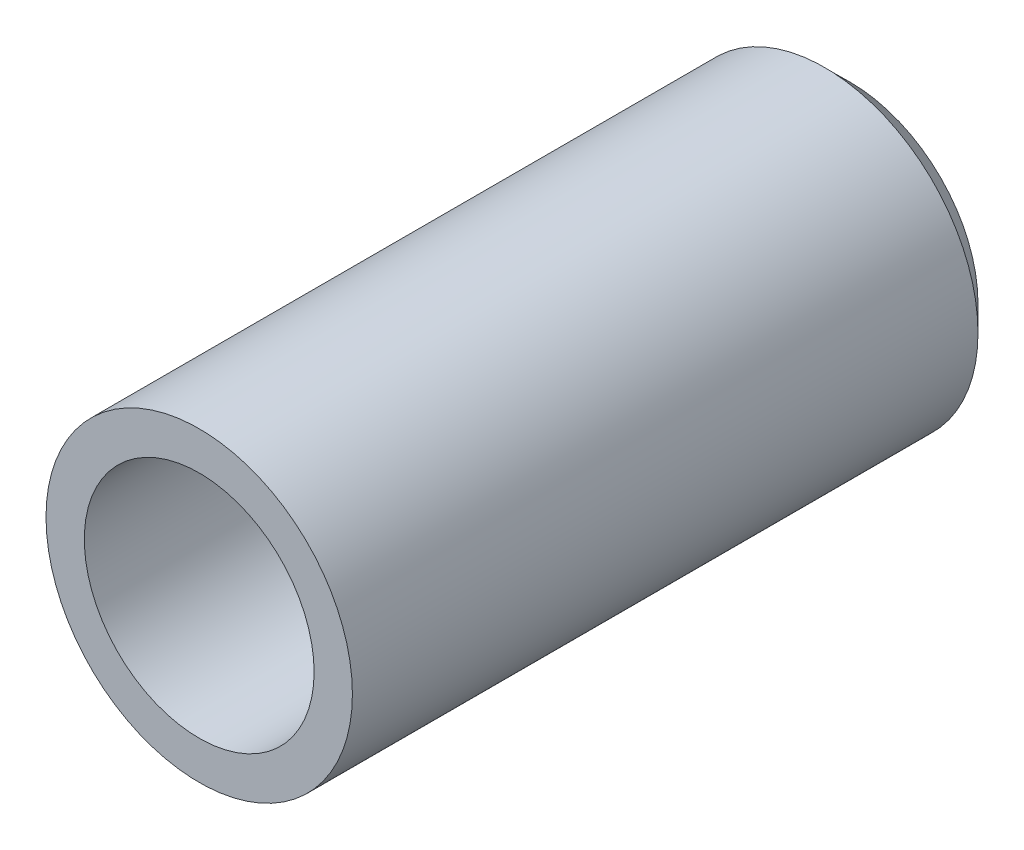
SolidWorks part; units mm, degrees
ref_plane "Face" through (0, 0, 0) normal (0, 0, 1) x (1, 0, 0)
ref_plane "Dessus" through (0, 0, 0) normal (0, 1, 0) x (1, 0, 0)
ref_plane "Droite" through (0, 0, 0) normal (1, 0, 0) x (0, 0, -1)
sketch "Esquisse1" plane through (0, 0, 0) normal (0, 0, 1) x (1, 0, 0)
  circle A0 centre (0, 0) radius 6
  dimension "D1" = 12
extrude "Base-Extrusion" add sketch "Esquisse1" along normal blind 25.5
sketch "Esquisse2" plane through (0, 0, 25.5) normal (0, 0, 1) x (1, 0, 0)
  circle A0 centre (0, 0) radius 4.5
  dimension "D1" = 9
extrude "Enlèv. mat.-Extru.1" cut sketch "Esquisse2" against normal blind 22.5
sketch "Esquisse3" plane through (0, 0, 0) normal (0, 0, -1) x (-1, 0, 0)
  circle A0 centre (0, 0) radius 3.02
  dimension "D1" = 6.04
extrude "Enlèv. mat.-Extru.2" cut sketch "Esquisse3" against normal through all
chamfer "Chanfrein1" distance 0.5 angle 45 1 edges at (3.02, 0, 3)
fillet "Congé1" radius 0.5 1 edges at (4.5, 0, 3)
chamfer "Chanfrein2" distance 1 angle 45 1 edges at (6, 0, 0)
thread "Filetage1" pitch 1.75 start angle 0, offset 5, length 35, pitch 1.75, diameter 12
ref_plane "Plan1" through (6, 0, -4) normal (0, -1, 0) x (1, 0, 0)
sketch "Profil de filetage1" plane through (6, 0, -4) normal (0, -1, 0) x (1, 0, 0)
  line L0 (0, 0) -> (0, 1.75) construction
  line L11 (0, 0) -> (0, 1.5312)
  line L12 (0, 1.5312) -> (-0.9472, 0.9844)
  line L13 (-0.9472, 0.9844) -> (-0.9472, 0.5469)
  line L15 (-0.9472, 0.5469) -> (0, 0)
  line L17 (-0.9472, 0.7656) -> (0, 0.7656) construction
  point P2 (0, 0)
  dimension "Pitch" = 1.75
  dimension "Profile_Angle" = 60
  dimension "Profile_Land" = 0.4375
  dimension "Profile_Height" = 0.9472
